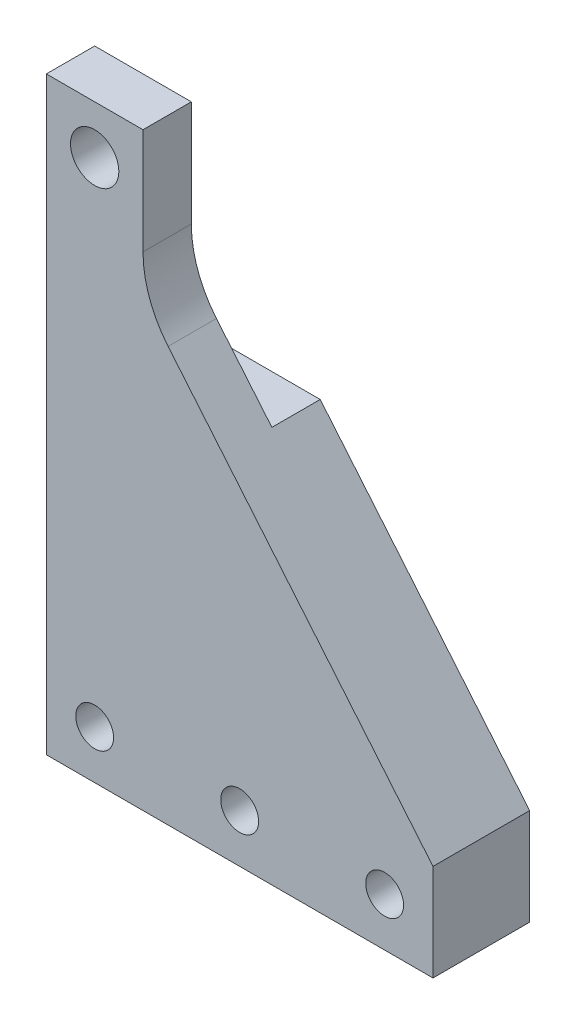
SolidWorks part; units mm, degrees
ref_plane "Front" through (0, 0, 0) normal (0, 0, 1) x (1, 0, 0)
ref_plane "Top" through (0, 0, 0) normal (0, 1, 0) x (1, 0, 0)
ref_plane "Right" through (0, 0, 0) normal (1, 0, 0) x (0, 0, -1)
sketch "Sketch1" plane through (0, 0, 0) normal (0, 0, 1) x (1, 0, 0)
  line L0 (0, 0) -> (0, 64.77) construction
  line L1 (19.05, 0) -> (38.1, 0) construction
  line L3 (-6.35, -6.35) -> (44.45, -6.35)
  line L4 (-6.35, -6.35) -> (-6.35, 71.12)
  line L5 (-6.35, 71.12) -> (44.45, 71.12)
  line L6 (44.45, -6.35) -> (44.45, 71.12)
  circle A0 centre (0, 0) radius 2.4892
  circle A1 centre (38.1, 0) radius 2.4892
  circle A2 centre (19.05, 0) radius 2.4892
  circle A3 centre (0, 64.77) radius 3.175
  dimension "D3" = 4.9784
  dimension "D9" = 6.35
  dimension "D1" = 64.77
  dimension "D2" = 19.05
  dimension "D4" = 6.35
  dimension "D5" = 6.35
  dimension "D6" = 6.35
  dimension "D7" = 6.35
  dimension "D8" = 19.05
extrude "Boss-Extrude1" add sketch "Sketch1" along normal blind 12.7
sketch "Sketch2" plane through (0, 0, 12.7) normal (0, 0, 1) x (1, 0, 0)
  line L0 (44.45, 6.35) -> (6.35, 52.07)
  line L2 (44.45, -6.35) -> (44.45, 71.12) construction
  line L3 (6.35, 71.12) -> (44.45, 71.12)
  line L4 (44.45, 71.12) -> (44.45, 6.35)
  line L5 (6.35, 52.07) -> (6.35, 71.12)
  dimension "D1" = 12.7
  dimension "D2" = 12.7
  dimension "D3" = 19.05
extrude "Cut-Extrude1" cut sketch "Sketch2" against normal through all
sketch "Sketch3" plane through (0, 0, 12.7) normal (0, 0, 1) x (1, 0, 0)
  line L0 (-6.35, 39.37) -> (16.9333, 39.37)
  line L1 (-6.35, 71.12) -> (-6.35, -6.35) construction
  line L3 (6.35, 71.12) -> (-6.35, 71.12) construction
  line L4 (-6.35, 39.37) -> (-6.35, 71.12)
  line L5 (-6.35, 71.12) -> (6.35, 71.12)
  line L6 (6.35, 71.12) -> (6.35, 52.07)
  line L7 (6.35, 52.07) -> (44.45, 6.35) construction
  line L8 (6.35, 52.07) -> (16.9333, 39.37)
  dimension "D1" = 31.75
extrude "Cut-Extrude2" cut sketch "Sketch3" along normal blind 6.35 from surface at -12.7
fillet "Fillet1" radius 14.224 1 edges at (6.35, 52.07, 9.525)
